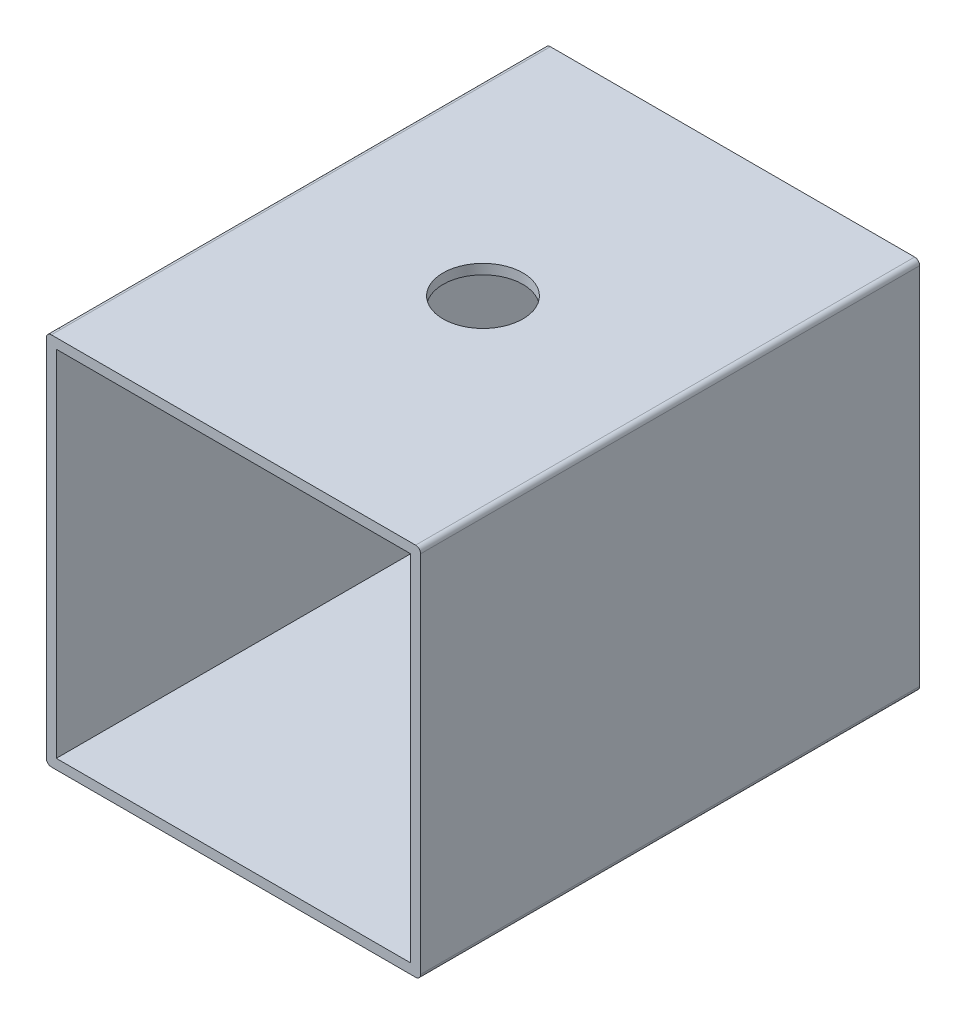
SolidWorks part; units mm, degrees
ref_plane "Plan de face" through (0, 0, 0) normal (0, 0, 1) x (1, 0, 0)
ref_plane "Plan de dessus" through (0, 0, 0) normal (0, 1, 0) x (1, 0, 0)
ref_plane "Plan de droite" through (0, 0, 0) normal (1, 0, 0) x (0, 0, -1)
sketch "Esquisse1" plane through (0, 0, 0) normal (0, 0, 1) x (1, 0, 0)
  line L0 (4, 4) -> (4, 146)
  line L1 (2, 0) -> (148, 0)
  line L2 (0, 2) -> (0, 148)
  line L3 (2, 150) -> (148, 150)
  line L4 (150, 2) -> (150, 148)
  line L5 (4, 146) -> (146, 146)
  line L6 (146, 4) -> (146, 146)
  line L7 (4, 4) -> (146, 4)
  arc A0 (2, 0) -> (0, 2) centre (2, 2) cw
  arc A1 (148, 0) -> (150, 2) centre (148, 2) ccw
  arc A2 (148, 150) -> (150, 148) centre (148, 148) cw
  arc A3 (0, 148) -> (2, 150) centre (2, 148) cw
  arc A4 (4, 146) -> (4, 146) centre (4, 146) cw
  arc A5 (146, 146) -> (146, 146) centre (146, 146) cw
  arc A6 (146, 4) -> (146, 4) centre (146, 4) ccw
  arc A7 (4, 4) -> (4, 4) centre (4, 4) cw
  point P7 (0, 0)
  point P12 (150, 150)
  point P15 (0, 150)
  dimension "D3" = 2
  dimension "D1" = 150
  dimension "D2" = 150
  dimension "D4" = 4
extrude "Boss.-Extru.1" add sketch "Esquisse1" along normal blind 200
sketch "Esquisse2" plane through (0, 150, 0) normal (0, 1, 0) x (1, 0, 0)
  line L0 (2, -200) -> (148, 0) construction
  circle A0 centre (75, -100) radius 16
  dimension "D1" = 32
extrude "Enlèv. mat.-Extru.1" cut sketch "Esquisse2" against normal blind 10
